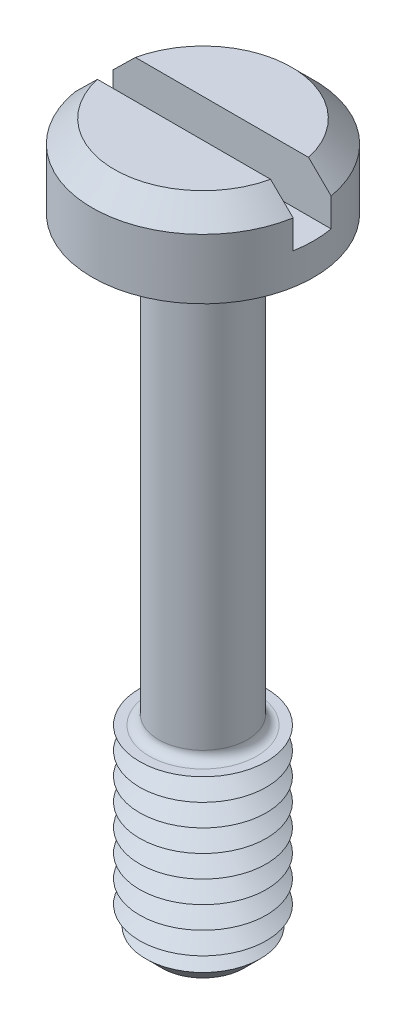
SolidWorks part; units mm, degrees
ref_plane "Front Plane" through (0, 0, 0) normal (0, 0, 1) x (1, 0, 0)
ref_plane "Top Plane" through (0, 0, 0) normal (0, 1, 0) x (1, 0, 0)
ref_plane "Right Plane" through (0, 0, 0) normal (1, 0, 0) x (0, 0, -1)
sketch "Sketch1" plane through (0, 0, 0) normal (0, 1, 0) x (1, 0, 0)
  circle A0 centre (0, 0) radius 3.5
  dimension "D1" = 7
extrude "Boss-Extrude1" add sketch "Sketch1" along normal blind 2.6
sketch "Sketch2" plane through (0, 0, 0) normal (0, -1, 0) x (1, 0, 0)
  circle A0 centre (0, 0) radius 1.4
  dimension "D1" = 2.8
extrude "Boss-Extrude2" add sketch "Sketch2" along normal blind 20
sketch "Sketch3" plane through (0, -20, 0) normal (0, -1, 0) x (1, 0, 0)
  circle A0 centre (0, 0) radius 2
  dimension "D1" = 4
extrude "Boss-Extrude3" add sketch "Sketch3" against normal blind 6
chamfer "Chamfer1" distance 0.7 angle 45 1 edges at (0, -20, -2)
sketch "Sketch4" plane through (0, 0, 0) normal (1, 0, 0) x (0, 0, -1)
  line L0 (0, -6.5871) -> (0, -12.0372) construction
sketch "Sketch5" plane through (0, 0, 0) normal (1, 0, 0) x (0, 0, -1)
  line L0 (-2, -14) -> (-1.3938, -14.35)
  line L1 (-1.3938, -14.35) -> (-2, -14.7)
  line L2 (-2, -14) -> (-2, -19.3) construction
  line L3 (-2, -14.7) -> (-2, -14)
  dimension "D1" = 0.7
revolve "Cut-Revolve1" cut sketch "Sketch5" angle 360 about L0
pattern_linear "LPattern1" count 8 spacing 0.7 along (0, -1, 0) of "Cut-Revolve1"
fillet "Fillet1" radius 0.3 2 edges at (0, -14, -1.4) (0, 0, -1.4)
chamfer "Chamfer2" distance 0.7 angle 45 1 edges at (0, 2.6, 3.5)
sketch "Sketch6" plane through (0, 2.6, 0) normal (0, 1, 0) x (1, 0, 0)
  line L1 (3.5, -0.6) -> (-3.5, -0.6)
  line L2 (3.5, -0.6) -> (3.5, 0.6)
  line L3 (3.5, 0.6) -> (-3.5, 0.6)
  line L4 (-3.5, -0.6) -> (-3.5, 0.6)
  line L5 (3.5, -0.6) -> (-3.5, 0.6) construction
  line L6 (3.5, 0.6) -> (-3.5, -0.6) construction
  circle A0 centre (0, 0) radius 3.5 construction
  point P0 (0, 0)
  dimension "D1" = 1.2
extrude "Cut-Extrude1" cut sketch "Sketch6" against normal blind 1.6
